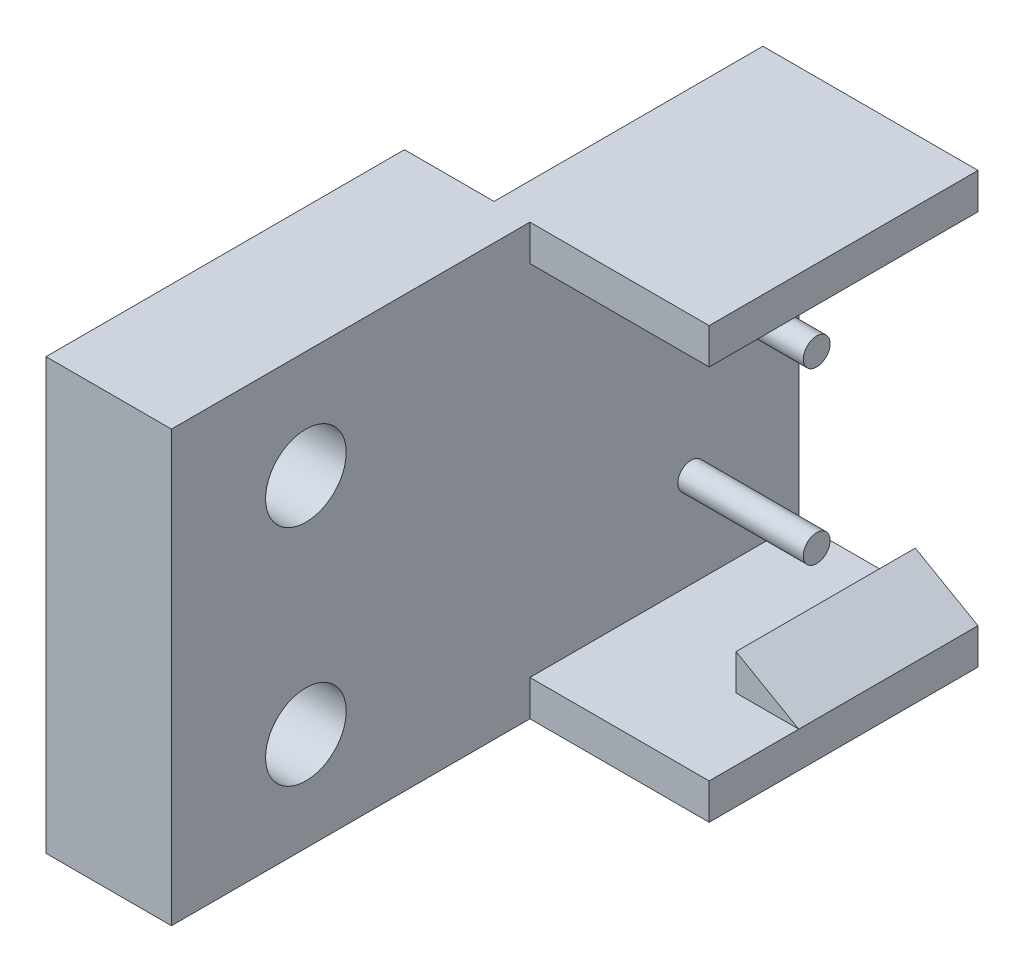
SolidWorks part; units mm, degrees
ref_plane "Ebene vorne" through (0, 0, 0) normal (0, 0, 1) x (1, 0, 0)
ref_plane "Ebene oben" through (0, 0, 0) normal (0, 1, 0) x (1, 0, 0)
ref_plane "Ebene rechts" through (0, 0, 0) normal (1, 0, 0) x (0, 0, -1)
sketch "Skizze1" plane through (0, 0, 0) normal (1, 0, 0) x (0, 0, -1)
  line L1 (0, 0) -> (15, 0)
  line L2 (0, 0) -> (0, 24)
  line L3 (0, 24) -> (15, 24)
  line L4 (15, 0) -> (15, 24)
  dimension "D1" = 15
  dimension "D2" = 24
extrude "Aufsatz-Linear austragen1" add sketch "Skizze1" along normal blind 2
sketch "Skizze2" plane through (2, 0, 0) normal (1, 0, 0) x (0, 0, -1)
  line L0 (15, 0) -> (15, 24) construction
  line L1 (0, 24) -> (15, 24)
  line L2 (0, 24) -> (0, 22)
  line L3 (0, 22) -> (15, 22)
  line L4 (15, 24) -> (15, 22)
  line L6 (0, 0) -> (15, 0)
  line L7 (0, 0) -> (0, 2)
  line L8 (0, 2) -> (15, 2)
  line L9 (15, 0) -> (15, 2)
  dimension "D1" = 20
  dimension "D2" = 2
extrude "Aufsatz-Linear austragen2" add sketch "Skizze2" along normal blind 10
sketch "Skizze3" plane through (0, 0, -15) normal (0, 0, -1) x (-1, 0, 0)
  line L0 (-12, 22) -> (-8.5, 20)
  line L1 (-8.5, 20) -> (-8.5, 22)
  line L2 (-12, 22) -> (-2, 22) construction
  line L3 (-2, 2) -> (-2, 22) construction
  line L4 (-12, 2) -> (-8.5, 4)
  line L5 (-8.5, 4) -> (-8.5, 2)
  line L6 (-12, 2) -> (-2, 2) construction
  line L7 (-12, 22) -> (-8.5, 22)
  line L8 (-12, 2) -> (-8.5, 2)
  dimension "D1" = 6.5
  dimension "D2" = 2
  dimension "D3" = 2
extrude "Aufsatz-Linear austragen3" add sketch "Skizze3" against normal blind 10
sketch "Skizze5" plane through (2, 0, 0) normal (1, 0, 0) x (0, 0, -1)
  line L0 (0, 22) -> (5, 22) construction
  line L2 (15, 2) -> (15, 22) construction
  circle A0 centre (9, 16.75) radius 0.75
  circle A1 centre (9, 7.25) radius 0.75
  dimension "D1" = 1.5
  dimension "D2" = 1.5
  dimension "D3" = 9.5
  dimension "D4" = 5.25
  dimension "D5" = 6
extrude "Aufsatz-Linear austragen5" add sketch "Skizze5" along normal blind 7
sketch "Skizze10" plane through (0, 0, 0) normal (-1, 0, 0) x (0, 0, 1)
  line L1 (0, 24) -> (20, 24)
  line L2 (0, 24) -> (0, 0)
  line L3 (0, 0) -> (20, 0)
  line L4 (20, 24) -> (20, 0)
  circle A0 centre (12.5, 18) radius 2.25
  circle A1 centre (12.5, 5.5) radius 2.25
  point P11 (-4.0617, 19.9569)
  dimension "D2" = 4.5
  dimension "D3" = 4.5
  dimension "D1" = 20
  dimension "D4" = 12.5
  dimension "D5" = 5.5
  dimension "D6" = 7.5
  dimension "D7" = 7.5
extrude "Aufsatz-Linear austragen7" add sketch "Skizze10" against normal blind 2 and the other way blind 5
